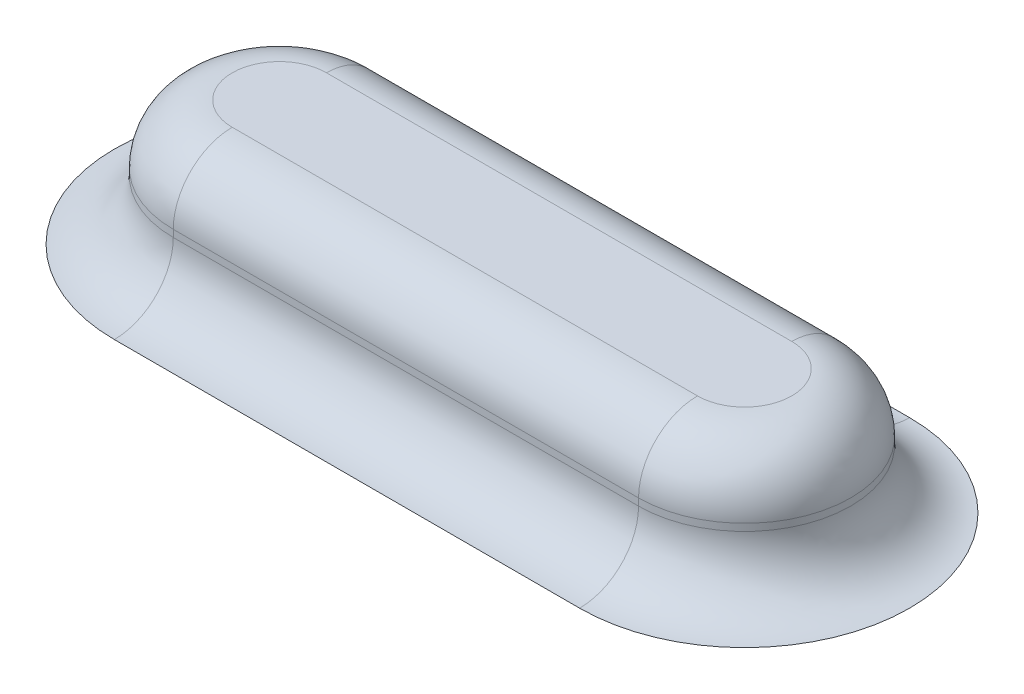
SolidWorks part; units mm, degrees
ref_plane "Front Plane" through (0, 0, 0) normal (0, 0, 1) x (1, 0, 0)
ref_plane "Top Plane" through (0, 0, 0) normal (0, 1, 0) x (1, 0, 0)
ref_plane "Right Plane" through (0, 0, 0) normal (1, 0, 0) x (0, 0, -1)
sketch "Sketch1" plane through (0, 0, 0) normal (0, 1, 0) x (1, 0, 0)
  line L1 (-114.0405, 85.21) -> (116.6032, 85.21)
  line L2 (-114.0405, 85.21) -> (-114.0405, -59.5829)
  line L3 (-114.0405, -59.5829) -> (116.6032, -59.5829)
  line L4 (116.6032, 85.21) -> (116.6032, -59.5829)
extrude "Extrude1" add sketch "Sketch1" along normal blind 26.924
sketch "Sketch2" plane through (0, 26.924, 0) normal (0, 1, 0) x (1, 0, 0)
  line L0 (-63.8059, 23.9387) -> (36.4612, 23.9387) construction
  line L1 (-63.8059, 1.0787) -> (36.4612, 1.0787)
  line L2 (-63.8059, 46.7987) -> (36.4612, 46.7987)
  arc A0 (-63.8059, 1.0787) -> (-63.8059, 46.7987) centre (-63.8059, 23.9387) cw
  arc A1 (36.4612, 1.0787) -> (36.4612, 46.7987) centre (36.4612, 23.9387) ccw
  dimension "D1" = 22.86
  dimension "D2" = 22.86
extrude "Extrude2" add sketch "Sketch2" along normal blind 26.924
fillet "Fillet1" radius 12.7 8 edges at (-13.6723, 26.924, -46.7987) (59.3212, 26.924, -23.9387) (-13.6723, 26.924, -1.0787) (-13.6723, 53.848, -46.7987) (59.3212, 53.848, -23.9387) (-13.6723, 53.848, -1.0787) (-86.6659, 26.924, -23.9387) (-86.6659, 53.848, -23.9387)
sketch "Sketch3" plane through (0, 26.924, 0) normal (0, 1, 0) x (1, 0, 0)
  line L4 (-114.0405, 85.21) -> (-114.0405, -59.5829)
  line L5 (-114.0405, -59.5829) -> (116.6032, -59.5829)
  line L6 (116.6032, -59.5829) -> (116.6032, 85.21)
  line L7 (116.6032, 85.21) -> (-114.0405, 85.21)
  line L8 (-114.0405, 85.21) -> (-114.0405, -59.5829)
  line L9 (-114.0405, -59.5829) -> (116.6032, -59.5829)
  line L10 (116.6032, -59.5829) -> (116.6032, 85.21)
  line L11 (116.6032, 85.21) -> (-114.0405, 85.21)
  dimension "D1" = 0
extrude "Cut-Extrude1" cut sketch "Sketch3" against normal blind 26.924
